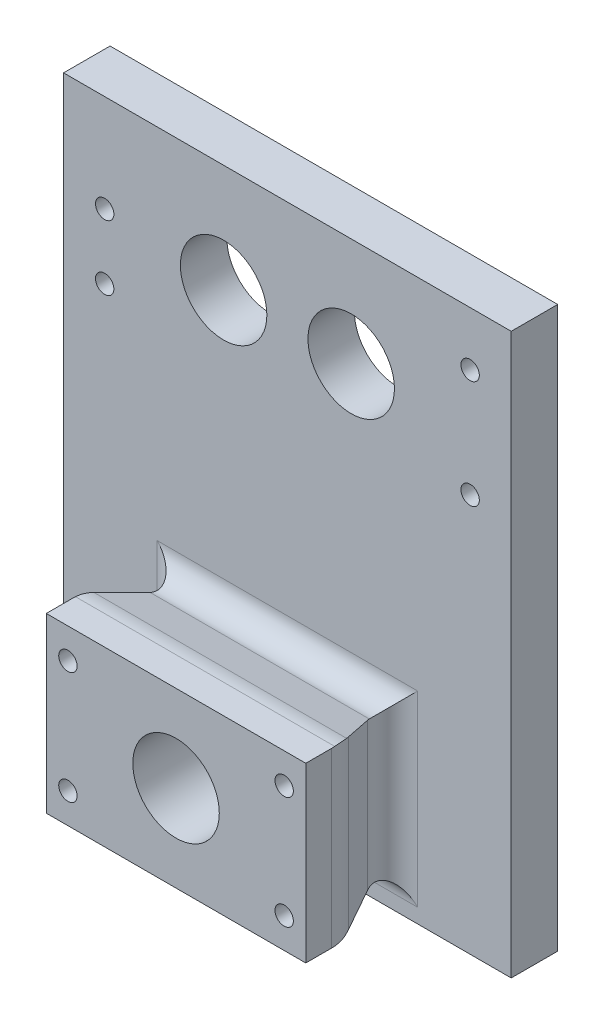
SolidWorks part; units mm, degrees
ref_plane "Plan de face" through (0, 0, 0) normal (0, 0, 1) x (1, 0, 0)
ref_plane "Plan de dessus" through (0, 0, 0) normal (0, 1, 0) x (1, 0, 0)
ref_plane "Plan de droite" through (0, 0, 0) normal (1, 0, 0) x (0, 0, -1)
sketch "Esquisse1" plane through (0, 0, 0) normal (0, 0, 1) x (1, 0, 0)
  line L1 (-60, 40) -> (60, 40)
  line L2 (-60, 40) -> (-60, -40)
  line L3 (-60, -40) -> (60, -40)
  line L4 (60, 40) -> (60, -40)
  dimension "D1" = 120
  dimension "D2" = 80
  dimension "D3" = 40
  dimension "D4" = 60
extrude "Boss.-Extru.1" add sketch "Esquisse1" along normal blind 17
ref_plane "Plan1" through (0, 0, -34.5) normal (0, 0, 1) x (1, 0, 0)
sketch "Esquisse2" plane through (0, 0, -34.5) normal (0, 0, 1) x (1, 0, 0)
  line L0 (60, -40) -> (60, 40) construction
  line L1 (45, -30) -> (-45, -30)
  line L2 (45, -30) -> (45, 30)
  line L3 (45, 30) -> (-45, 30)
  line L4 (-45, -30) -> (-45, 30)
  line L5 (-60, 40) -> (-60, -40) construction
  line L6 (-60, -40) -> (60, -40) construction
  line L7 (60, 40) -> (-60, 40) construction
  dimension "D1" = 15
  dimension "D2" = 15
  dimension "D3" = 10
  dimension "D4" = 10
sketch "Esquisse3" plane through (0, 0, 0) normal (0, 0, -1) x (-1, 0, 0)
  line L4 (60, -40) -> (60, 40)
  line L5 (60, 40) -> (-60, 40)
  line L6 (-60, 40) -> (-60, -40)
  line L7 (-60, -40) -> (60, -40)
  line L8 (60, -40) -> (60, 40)
  line L9 (60, 40) -> (-60, 40)
  line L10 (-60, 40) -> (-60, -40)
  line L11 (-60, -40) -> (60, -40)
  dimension "D1" = 0
loft "Lissage1" add profiles "Esquisse3", "Esquisse2"
sketch "Esquisse4" plane through (0, 0, -34.5) normal (0, 0, 1) x (1, 0, 0)
  line L0 (-60, -40) -> (60, -40) construction
  line L1 (103.5, -50) -> (-103.5, -50)
  line L2 (103.5, -50) -> (103.5, 209)
  line L3 (103.5, 209) -> (-103.5, 209)
  line L4 (-103.5, -50) -> (-103.5, 209)
  dimension "D1" = 259
  dimension "D2" = 207
  dimension "D3" = 103.5
  dimension "D4" = 10
extrude "Boss.-Extru.2" add sketch "Esquisse4" against normal blind 21.5
sketch "Esquisse5" plane through (0, 0, 17) normal (0, 0, 1) x (1, 0, 0)
  circle A0 centre (0, 0) radius 20
  dimension "D1" = 40
extrude "Enlèv. mat.-Extru.2" cut sketch "Esquisse5" against normal through all
fillet "Congé1" radius 25 4 edges at (0, -40, 0) (-60, 0, 0) (0, 40, 0) (60, 0, 0)
fillet "Congé2" radius 10 4 edges
hole_wizard "Trou taraudé M101" positions "Esquisse8" profile "Esquisse7" tap size "M10" standard "ISO"
sketch "Esquisse8" plane through (0, 0, 17) normal (0, 0, 1) x (1, 0, 0)
  point P0 (-50, 26)
  point P3 (50, 26)
  point P6 (50, -26)
  point P9 (-50, -26)
sketch "Esquisse7" plane through (-50, 26, 17) normal (1, 0, 0) x (0, -1, 0)
  line L0 (0, 0) -> (0, 30.0537)
  line L1 (0, 30.0537) -> (4.25, 27.5)
  line L2 (4.25, 27.5) -> (4.25, 0)
  line L5 (4.25, 0) -> (0, 0)
  line L10 (0, 30.0537) -> (-4.25, 27.5) construction
  line L11 (0, -6.35) -> (0, 107.95) construction
  dimension "Diamètre du trou pour taraudage" = 8.5
  dimension "Profondeur du trou pour taraudage" = 27.5
  dimension "Angle de pointe" = 118
hole_wizard "Trou taraudé M102" positions "Esquisse10" profile "Esquisse9" tap size "M10" standard "ISO"
sketch "Esquisse10" plane through (0, 0, -34.5) normal (0, 0, 1) x (1, 0, 0)
  point P0 (84.5, 184)
  point P3 (84.5, 134)
  point P6 (-84.5, 164)
  point P9 (-84.5, 134)
sketch "Esquisse9" plane through (84.5, 184, -34.5) normal (1, 0, 0) x (0, -1, 0)
  line L0 (0, 0) -> (0, 21.5)
  line L1 (0, 21.5) -> (4.25, 21.5)
  line L2 (4.25, 21.5) -> (4.25, 0)
  line L5 (4.25, 0) -> (0, 0)
  line L11 (0, -6.35) -> (0, 107.95) construction
  dimension "Diamètre du trou pour taraudage jusqu'au prochain" = 8.5
  dimension "Profondeur du trou pour taraudage jusqu'au prochain" = 21.5
sketch "Esquisse11" plane through (0, 0, -34.5) normal (0, 0, 1) x (1, 0, 0)
  circle A0 centre (-29.5, 159) radius 20
  circle A1 centre (29.5, 159) radius 20
  dimension "D1" = 40
  dimension "D2" = 40
extrude "Enlèv. mat.-Extru.3" cut sketch "Esquisse11" against normal through all
